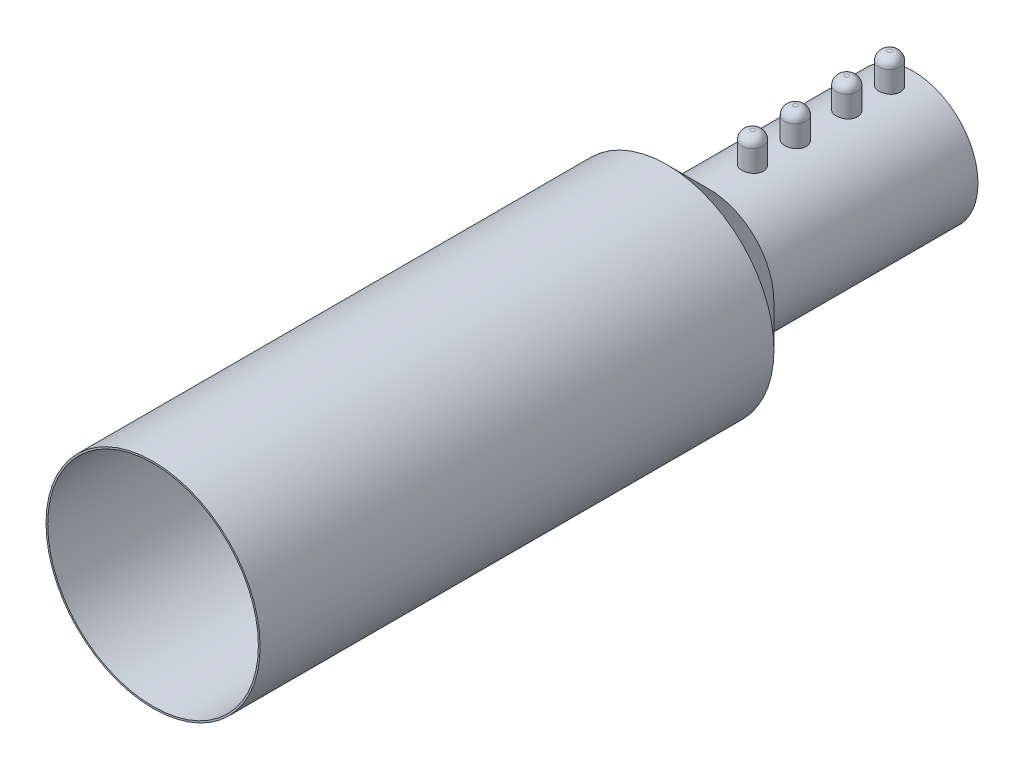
SolidWorks part; units mm, degrees
ref_plane "Front Plane" through (0, 0, 0) normal (0, 0, 1) x (1, 0, 0)
ref_plane "Top Plane" through (0, 0, 0) normal (0, 1, 0) x (1, 0, 0)
ref_plane "Right Plane" through (0, 0, 0) normal (1, 0, 0) x (0, 0, -1)
sketch "Sketch2" plane through (0, 0, 0) normal (0, 0, 1) x (1, 0, 0)
  circle A0 centre (0, 0) radius 19.177
  dimension "D1" = 38.354
extrude "Boss-Extrude1" add sketch "Sketch2" along normal blind 76.2
sketch "Sketch3" plane through (0, 0, 76.2) normal (0, 0, 1) x (1, 0, 0)
  circle A0 centre (0, 0) radius 31.75
  dimension "D1" = 63.5
extrude "Boss-Extrude2" add sketch "Sketch3" along normal blind 152.4
chamfer "Chamfer1" distance 12.54 angle 45 1 edges at (19.177, 0, 76.2)
chamfer "Chamfer2" distance 17.62 angle 10 1 edges at (19.177, 0, 0)
shell "Shell2" thickness 0.508
ref_plane "Plane1" through (0, 0, 2.54) normal (0, 0, 1) x (1, 0, 0)
sketch "Sketch4" plane through (0, 0, 2.54) normal (0, 0, 1) x (1, 0, 0)
  circle A0 centre (0, 0) radius 2.54
  dimension "D1" = 5.08
extrude "Boss-Extrude3" add sketch "Sketch4" against normal blind 8.382
fillet "Fillet1" radius 2.54 1 edges at (2.54, 0, -5.842)
ref_plane "Plane2" through (0, 2.54, 0) normal (0, 1, 0) x (1, 0, 0)
sketch "Sketch5" plane through (0, 2.54, 0) normal (0, 1, 0) x (1, 0, 0)
  circle A0 centre (0, -10.16) radius 3.175
  circle A1 centre (0, -22.86) radius 3.175
  circle A4 centre (0, -38.1) radius 3.175
  circle A5 centre (0, -50.8) radius 3.175
  dimension "D1" = 6.35
  dimension "D2" = 6.35
  dimension "D4" = 6.35
  dimension "D5" = 6.35
  dimension "D3" = 12.7
  dimension "D6" = 12.7
  dimension "D7" = 15.24
  dimension "D8" = 10.16
extrude "Boss-Extrude4" add sketch "Sketch5" along normal blind 25.4
fillet "Fillet2" radius 2.54 4 edges at (0, 27.94, 53.975) (0, 27.94, 41.275) (0, 27.94, 26.035) (0, 27.94, 13.335)
